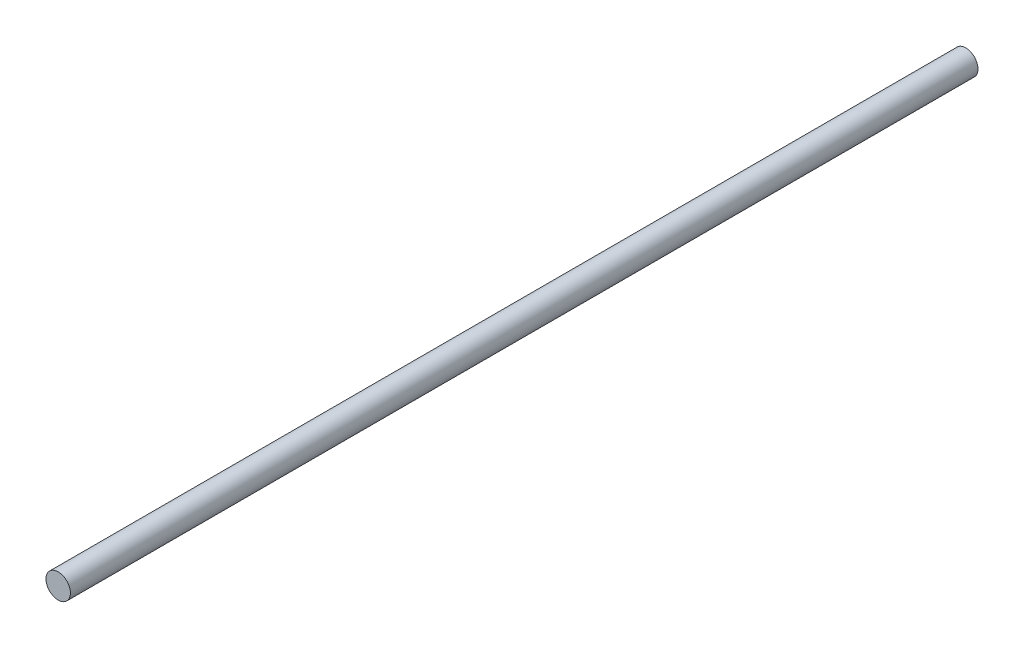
SolidWorks part; units mm, degrees
ref_plane "Front Plane" through (0, 0, 0) normal (0, 0, 1) x (1, 0, 0)
ref_plane "Top Plane" through (0, 0, 0) normal (0, 1, 0) x (1, 0, 0)
ref_plane "Right Plane" through (0, 0, 0) normal (1, 0, 0) x (0, 0, -1)
sketch "Sketch1" plane through (0, 0, 0) normal (0, 0, 1) x (1, 0, 0)
  circle A0 centre (0, 0) radius 4
  dimension "D1" = 8
extrude "Boss-Extrude1" add sketch "Sketch1" along normal mid plane 297
